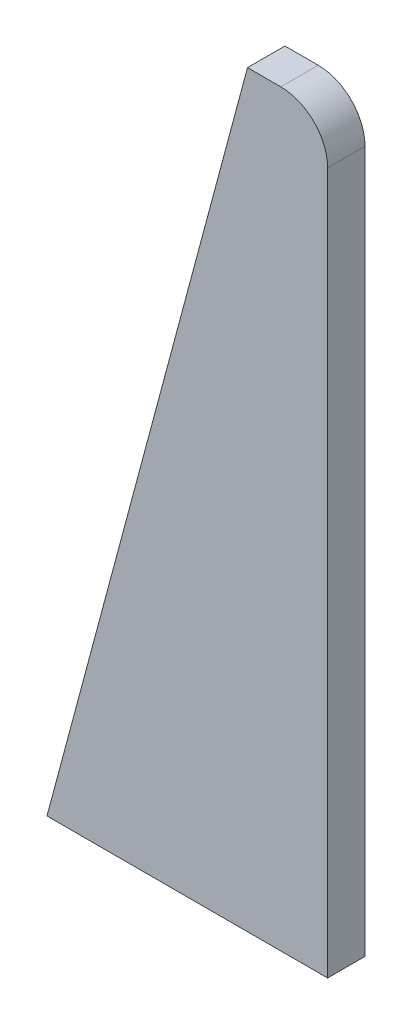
SolidWorks part; units mm, degrees
ref_plane "Przednia" through (0, 0, 0) normal (0, 0, 1) x (1, 0, 0)
ref_plane "Górna" through (0, 0, 0) normal (0, 1, 0) x (1, 0, 0)
ref_plane "Prawa" through (0, 0, 0) normal (1, 0, 0) x (0, 0, -1)
sketch "Szkic1" plane through (0, 0, 0) normal (0, 0, 1) x (1, 0, 0)
  line L0 (0, 0) -> (60, 0)
  line L1 (60, 0) -> (60, 160)
  line L2 (42.8719, 160) -> (0, 0)
  line L3 (42.8719, 160) -> (60, 160)
  dimension "D1" = 60
  dimension "D2" = 75
  dimension "D3" = 160
extrude "Dodanie-wyciągnięcie1" add sketch "Szkic1" along normal blind 8
hole_wizard "Otwór gwintowany M5x0.81" positions "Szkic3" profile "Szkic2" tap size "M5x0.8" standard "Ansi Metric"
sketch "Szkic3" plane through (0, 0, 0) normal (-0.9659, 0.2588, 0) x (0, 0, 1)
  line L0 (4, 0) -> (4, 35)
  line L1 (8, 0) -> (0, 0) construction
  line L2 (4, 35) -> (4, 110)
  point P0 (4, 35)
  point P2 (4, 110)
  dimension "D1" = 35
  dimension "D2" = 110
sketch "Szkic2" plane through (9.0587, 33.8074, 4) normal (0, 0, 1) x (-0.2588, -0.9659, 0)
  line L0 (0, 0) -> (0, 15.2618)
  line L1 (0, 15.2618) -> (2.1, 14)
  line L2 (2.1, 14) -> (2.1, 0)
  line L5 (2.1, 0) -> (0, 0)
  line L10 (0, 15.2618) -> (-2.1, 14) construction
  line L11 (0, -6.35) -> (0, 107.95) construction
  dimension "Średnica wiertła gwintu" = 4.2
  dimension "Głębokość otworu gwintowanego" = 14
  dimension "Kąt wiertła" = 118
hole_wizard "Otwór gwintowany M5x0.82" positions "Szkic5" profile "Szkic4" tap size "M5x0.8" standard "Ansi Metric"
sketch "Szkic5" plane through (0, 0, 0) normal (0, -1, 0) x (-1, 0, 0)
  line L0 (0, -4) -> (-22, -4)
  line L1 (0, -8) -> (0, 0) construction
  line L2 (-22, -4) -> (-52, -4)
  point P0 (-22, -4)
  point P2 (-52, -4)
  dimension "D1" = 30
  dimension "D2" = 22
sketch "Szkic4" plane through (22, 0, 4) normal (1, 0, 0) x (0, 0, -1)
  line L0 (0, 0) -> (0, 15.2618)
  line L1 (0, 15.2618) -> (2.1, 14)
  line L2 (2.1, 14) -> (2.1, 0)
  line L5 (2.1, 0) -> (0, 0)
  line L10 (0, 15.2618) -> (-2.1, 14) construction
  line L11 (0, -6.35) -> (0, 107.95) construction
  dimension "Średnica wiertła gwintu" = 4.2
  dimension "Głębokość otworu gwintowanego" = 14
  dimension "Kąt wiertła" = 118
fillet "Zaokrąglenie1" radius 10 1 edges at (60, 160, 4)
